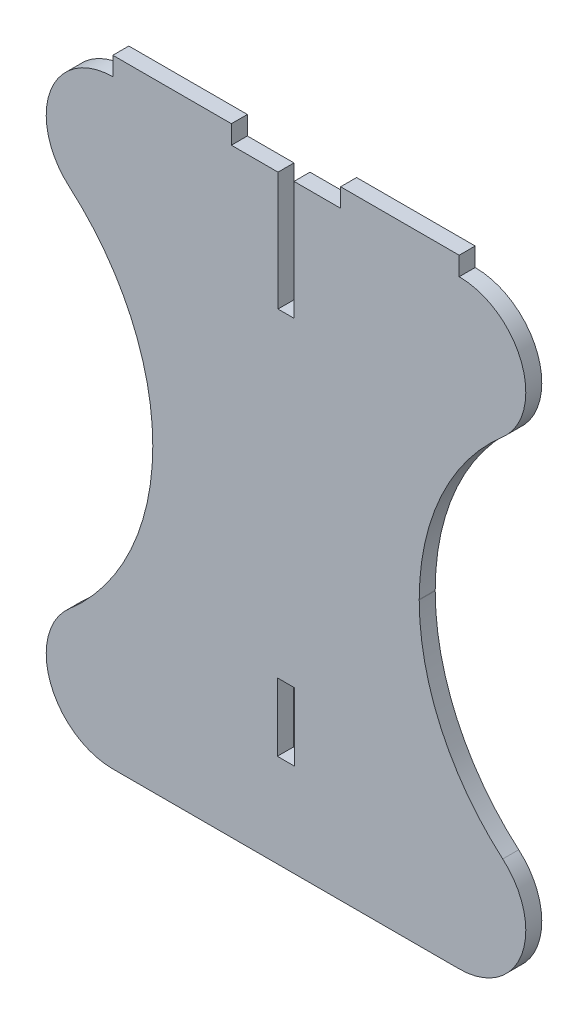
SolidWorks part; units mm, degrees
ref_plane "Front Plane" through (0, 0, 0) normal (0, 0, 1) x (1, 0, 0)
ref_plane "Top Plane" through (0, 0, 0) normal (0, 1, 0) x (1, 0, 0)
ref_plane "Right Plane" through (0, 0, 0) normal (1, 0, 0) x (0, 0, -1)
sketch "Sketch1" plane through (0, 0, 0) normal (0, 0, 1) x (1, 0, 0)
  line L0 (-4878.7664, 0) -> (239059.5532, 0) construction
  line L1 (0, -4878.7664) -> (0, 239059.5532) construction
  line L2 (0, 350) -> (360, 350) construction
  line L3 (0, 0) -> (360, 0) construction
  line L4 (0, 0) -> (0, 450) construction
  line L5 (0, 450) -> (360, 450) construction
  line L6 (360, 0) -> (360, 450) construction
  line L7 (0, 100) -> (360, 100) construction
  line L8 (80, 450) -> (80, 0) construction
  line L9 (280, 450) -> (280, 0) construction
  line L10 (80, 350) -> (80, 100)
  line L11 (50, 450) -> (50, 350) construction
  line L12 (80, 100) -> (50, 100)
  line L13 (80, 350) -> (50, 350)
  line L14 (50, 450) -> (310, 450)
  line L15 (310, 350) -> (280, 350)
  line L16 (280, 350) -> (280, 100)
  line L17 (280, 100) -> (310, 100)
  line L18 (310, 0) -> (50, 0)
  line L19 (180, 450) -> (180, 0) construction
  arc A0 (50, 450) -> (50, 350) centre (50, 400) ccw
  arc A1 (310, 450) -> (310, 350) centre (310, 400) cw
  arc A2 (310, 0) -> (310, 100) centre (310, 50) ccw
  arc A3 (50, 0) -> (50, 100) centre (50, 50) cw
  point P20 (0, 400)
  point P23 (0, 400)
  point P24 (50, 350)
  dimension "D1" = 450
  dimension "D2" = 360
  dimension "D3" = 100
  dimension "D4" = 100
  dimension "D5" = 200
  dimension "D6" = 80
  dimension "D8" = 30
extrude "Boss-Extrude2" add sketch "Sketch1" along normal blind 12
fillet "Fillet2" radius 181 4 edges at (80, 100, 6) (280, 100, 6) (280, 350, 6) (80, 350, 6)
sketch "Sketch2" plane through (0, 0, 12) normal (0, 0, 1) x (1, 0, 0)
  line L0 (50, 450) -> (50, 464)
  line L1 (50, 464) -> (139, 464)
  line L2 (139, 464) -> (139, 450)
  line L3 (310, 450) -> (50, 450) construction
  line L4 (310, 450) -> (310, 464)
  line L5 (310, 464) -> (221, 464)
  line L6 (221, 464) -> (221, 450)
  line L7 (50, 450) -> (139, 450)
  line L8 (221, 450) -> (310, 450)
  dimension "D1" = 14
  dimension "D2" = 14
  dimension "D3" = 89
  dimension "D4" = 89
extrude "Boss-Extrude4" add sketch "Sketch2" against normal blind 12
sketch "Sketch3" plane through (0, 0, 12) normal (0, 0, 1) x (1, 0, 0)
  line L0 (180, 450) -> (180, 0) construction
  line L1 (221, 450) -> (139, 450) construction
  line L2 (50, 0) -> (310, 0) construction
  line L3 (174, 450) -> (174, 361)
  line L4 (174, 361) -> (186, 361)
  line L5 (186, 361) -> (186, 450)
  line L6 (174, 450) -> (180, 450)
  line L7 (180, 450) -> (186, 450)
  line L8 (173.5, 121) -> (186.5, 121)
  line L9 (186.5, 121) -> (186.5, 70)
  line L10 (186.5, 70) -> (173.5, 70)
  line L11 (173.5, 70) -> (173.5, 121)
  dimension "D1" = 6
  dimension "D2" = 6
  dimension "D3" = 89
  dimension "D4" = 51
  dimension "D5" = 13
  dimension "D6" = 70
  dimension "D7" = 6.5
extrude "Cut-Extrude1" cut sketch "Sketch3" against normal blind 12
